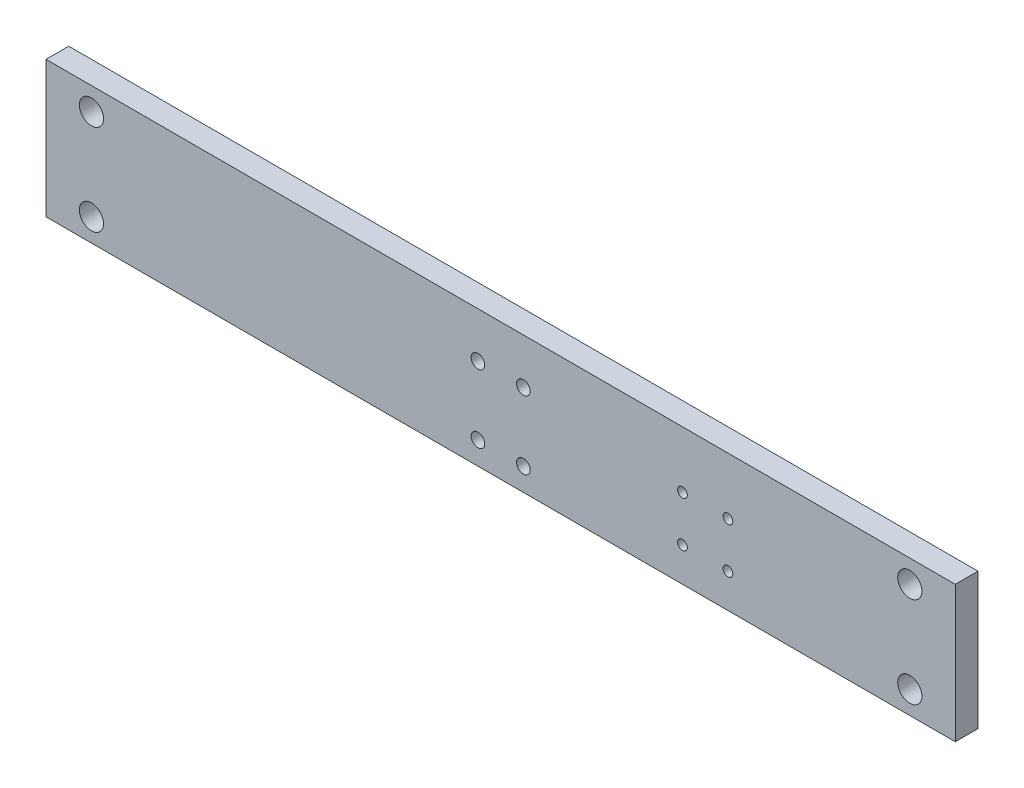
SolidWorks part; units mm, degrees
ref_plane "Front" through (0, 0, 0) normal (0, 0, 1) x (1, 0, 0)
ref_plane "Top" through (0, 0, 0) normal (0, 1, 0) x (1, 0, 0)
ref_plane "Right" through (0, 0, 0) normal (1, 0, 0) x (0, 0, -1)
sketch "Sketch1" plane through (0, 0, 0) normal (0, 0, 1) x (1, 0, 0)
  line L0 (127, 19.05) -> (-127, -19.05) construction
  line L1 (-127, 19.05) -> (127, 19.05)
  line L2 (-127, 19.05) -> (-127, -19.05)
  line L3 (-127, -19.05) -> (127, -19.05)
  line L4 (127, 19.05) -> (127, -19.05)
  dimension "D1" = 38.1
  dimension "D2" = 254
extrude "Extrude1" add sketch "Sketch1" along normal blind 6.35
hole_wizard "#6 Clearance Hole1" positions "Sketch3" profile "Sketch2" hole size "#6" standard "Ansi Inch"
sketch "Sketch3" plane through (0, 0, 0) normal (0, 0, -1) x (-1, 0, 0)
  line L0 (0, 0) -> (0, -28.8622) construction
  line L4 (-127, 19.05) -> (127, 19.05) construction
  point P0 (-6.35, -12.7)
  point P12 (6.35, -12.7)
  point P14 (-6.35, 6.35)
  point P15 (6.35, 6.35)
  dimension "D1" = 12.7
  dimension "D2" = 19.05
  dimension "D3" = 12.7
sketch "Sketch2" plane through (6.35, -12.7, 0) normal (1, 0, 0) x (0, 1, 0)
  line L0 (0, 0) -> (0, 79.8808)
  line L1 (0, 79.8808) -> (1.8986, 78.74)
  line L2 (1.8986, 78.74) -> (1.8986, 0)
  line L5 (1.8986, 0) -> (0, 0)
  line L10 (0, 79.8808) -> (-1.8987, 78.74) construction
  line L11 (0, -6.35) -> (0, 107.95) construction
  dimension "Hole Dia." = 3.7973
  dimension "Hole Depth" = 78.74
  dimension "Drill Angle" = 118
hole_wizard "1/4 Clearance Hole1" positions "Sketch5" profile "Sketch4" hole size "1/4" standard "Ansi Inch"
sketch "Sketch5" plane through (0, 0, 6.35) normal (0, 0, 1) x (1, 0, 0)
  line L0 (0, 0) -> (0, 40.2731) construction
  line L2 (-127, 19.05) -> (-127, -19.05) construction
  line L3 (127, 19.05) -> (-127, 19.05) construction
  point P0 (-114.3, 12.7)
  point P6 (-114.3, -12.7)
  point P9 (114.3, -12.7)
  point P10 (114.3, 12.7)
  dimension "D1" = 12.7
  dimension "D2" = 25.4
  dimension "D3" = 6.35
sketch "Sketch4" plane through (-114.3, 12.7, 6.35) normal (1, 0, 0) x (0, -1, 0)
  line L0 (0, 0) -> (0, 6.35)
  line L1 (0, 6.35) -> (3.3782, 6.35)
  line L2 (3.3782, 6.35) -> (3.3782, 0)
  line L5 (3.3782, 0) -> (0, 0)
  line L11 (0, -6.35) -> (0, 107.95) construction
  dimension "Thru Hole Dia." = 6.7564
  dimension "Thru Hole Depth" = 6.35
hole_wizard "#6-32 Tapped Hole2" positions "Sketch8" profile "Sketch7" tap size "#6-32" standard "Ansi Inch"
sketch "Sketch8" plane through (0, 0, 0) normal (0, 0, -1) x (-1, 0, 0)
  line L0 (-6.35, -12.7) -> (-6.35, 6.35) construction
  line L2 (-6.35, -3.175) -> (-68.7123, -3.175) construction
  point P0 (-50.8, 3.175)
  point P12 (-50.8, -9.525)
  point P13 (-63.5, -9.525)
  point P15 (-63.5, 3.175)
  dimension "D1" = 12.7
  dimension "D2" = 44.45
  dimension "D3" = 12.7
sketch "Sketch7" plane through (50.8, 3.175, 0) normal (1, 0, 0) x (0, 1, 0)
  line L0 (0, 0) -> (0, 6.35)
  line L1 (0, 6.35) -> (1.3525, 6.35)
  line L2 (1.3525, 6.35) -> (1.3525, 0)
  line L5 (1.3525, 0) -> (0, 0)
  line L11 (0, -6.35) -> (0, 107.95) construction
  dimension "Thru Tap Drill Dia." = 2.7051
  dimension "Thru Tap Drill Depth" = 6.35
